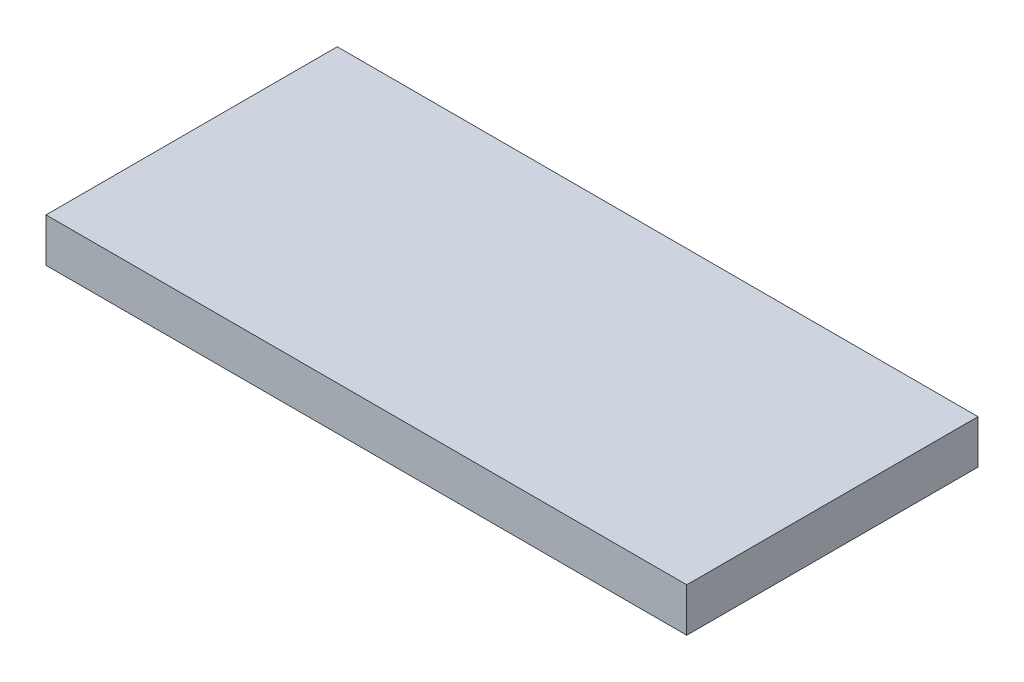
SolidWorks part; units mm, degrees
ref_plane "FRONT" through (0, 0, 0) normal (0, 0, 1) x (1, 0, 0)
ref_plane "TOP" through (0, 0, 0) normal (0, 1, 0) x (1, 0, 0)
ref_plane "RIGHT" through (0, 0, 0) normal (1, 0, 0) x (0, 0, -1)
sketch "Sketch1" plane through (0, 0, 0) normal (0, 1, 0) x (1, 0, 0)
  line L1 (-34.925, 15.875) -> (34.925, 15.875)
  line L2 (-34.925, 15.875) -> (-34.925, -15.875)
  line L3 (-34.925, -15.875) -> (34.925, -15.875)
  line L4 (34.925, 15.875) -> (34.925, -15.875)
  line L5 (-34.925, 15.875) -> (34.925, -15.875) construction
  line L6 (-34.925, -15.875) -> (34.925, 15.875) construction
  point P0 (0, 0)
  dimension "D1" = 69.85
  dimension "D2" = 31.75
extrude "Boss-Extrude1" add sketch "Sketch1" along normal blind 4.7625
